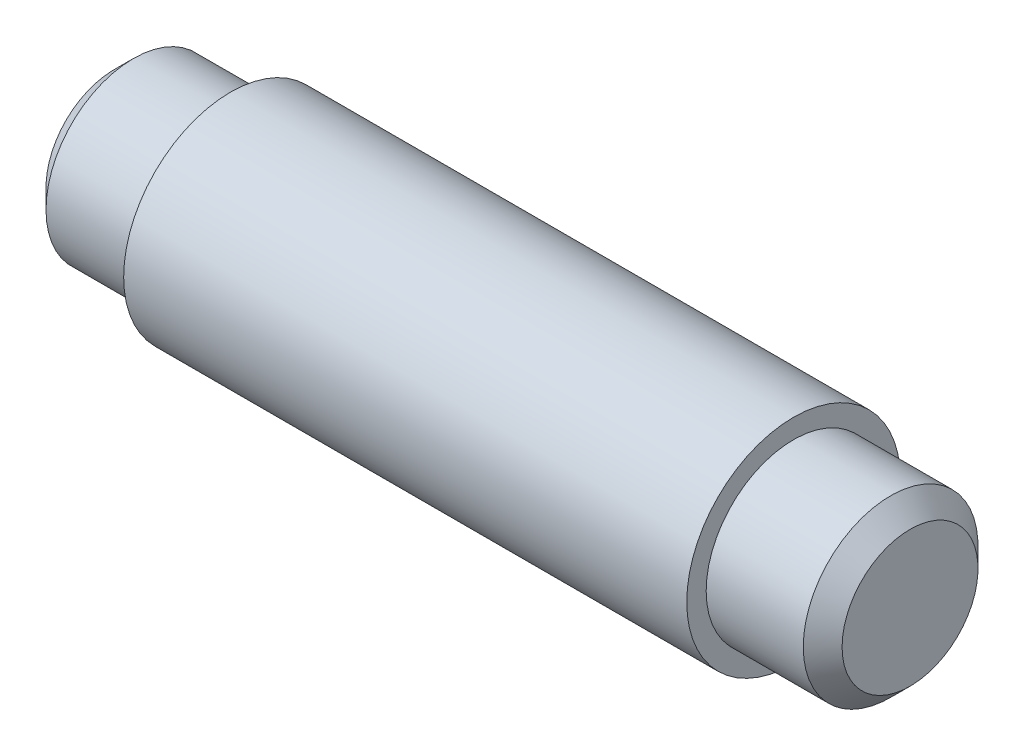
SolidWorks part; units mm, degrees
ref_plane "Front Plane" through (0, 0, 0) normal (0, 0, 1) x (1, 0, 0)
ref_plane "Top Plane" through (0, 0, 0) normal (0, 1, 0) x (1, 0, 0)
ref_plane "Right Plane" through (0, 0, 0) normal (1, 0, 0) x (0, 0, -1)
sketch "Sketch1" plane through (0, 0, 0) normal (0, 0, 1) x (1, 0, 0)
  line L0 (-41, 0) -> (41, 0)
  line L1 (41, 0) -> (41, 9)
  line L2 (41, 9) -> (29, 9)
  line L3 (29, 9) -> (29, 11)
  line L4 (29, 11) -> (-29, 11)
  line L5 (-29, 11) -> (-29, 9)
  line L6 (-29, 9) -> (-41, 9)
  line L7 (-41, 9) -> (-41, 0)
  line L8 (-50.0704, 0) -> (65.2574, 0) construction
  line L9 (0, -5.7951) -> (0, 25.2268) construction
  point P13 (25.9805, 9)
  dimension "D1" = 82
  dimension "D2" = 58
  dimension "D3" = 22
  dimension "D4" = 18
revolve "Revolve1" add sketch "Sketch1" angle 360 about L0
chamfer "Chamfer1" distance 2 angle 45 2 edges at (41, 0, 9) (-41, 0, 9)
